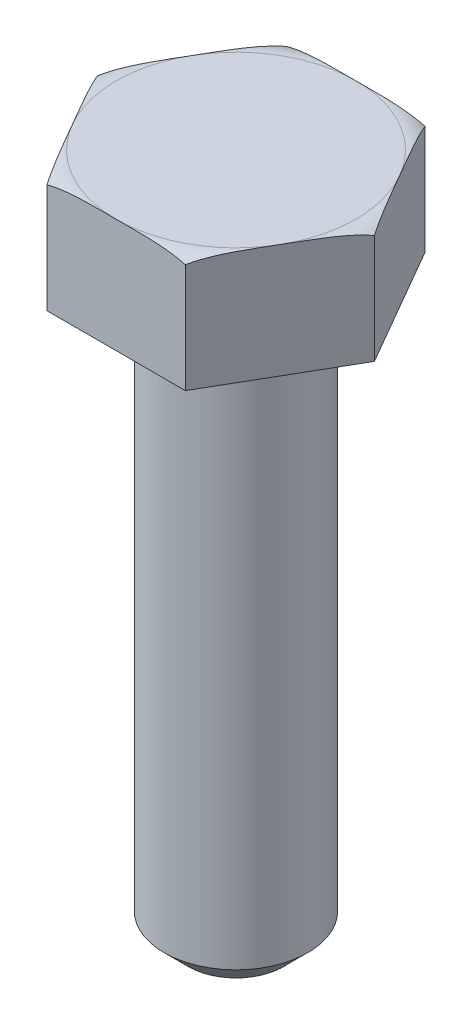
SolidWorks part; units mm, degrees
ref_plane "Plan1" through (0, 0, 0) normal (0, 0, 1) x (1, 0, 0)
ref_plane "Plan2" through (0, 0, 0) normal (0, 1, 0) x (1, 0, 0)
ref_plane "Plan3" through (0, 0, 0) normal (1, 0, 0) x (0, 0, -1)
sketch "Esquisse4" plane through (0, 0, 0) normal (0, 1, 0) x (1, 0, 0)
  line L1 (4.6188, 0) -> (2.3094, 4)
  line L2 (2.3094, 4) -> (-2.3094, 4)
  line L3 (-2.3094, 4) -> (-4.6188, 0)
  line L4 (-4.6188, 0) -> (-2.3094, -4)
  line L5 (-2.3094, -4) -> (2.3094, -4)
  line L6 (2.3094, -4) -> (4.6188, 0)
  circle A0 centre (0, 0) radius 4 construction
  dimension "S" = 8
extrude "Extrusion1" add sketch "Esquisse4" along normal blind 3.8
sketch "Esquisse1" plane through (0, 0, 0) normal (0, 0, 1) x (1, 0, 0)
  line L0 (0, 0) -> (0, -19) construction
  line L3 (0, 0) -> (2.64, 0)
  line L4 (2.4, -0.24) -> (2.4, -18.2)
  line L5 (1.6, -19) -> (0, -19)
  line L6 (2.4, -18.2) -> (1.6, -19)
  line L7 (0, -19) -> (0, 0)
  arc A1 (2.64, 0) -> (2.4, -0.24) centre (2.64, -0.24) ccw
  point P12 (2.4, -19)
  dimension "C2" = 0.24
  dimension "R" = 0.8
  dimension "D2" = 45
  dimension "L1" = 19
  dimension "D" = 4.8
revolve "Révolution1" add sketch "Esquisse1" angle 360 about L0
sketch "Esquisse2" plane through (0, 6, 0) normal (0, 0, -1) x (1, 0, 0)
  line L0 (4, 2.2) -> (4.6188, 2.2)
  line L1 (2.3094, 2.2) -> (4.6188, 2.2) construction
  line L2 (4.6188, 2.2) -> (4.6188, 6) construction
  line L3 (4.6188, 2.2) -> (4.6188, 2.3614)
  line L9 (4, 2.2) -> (4, 6) construction
  line L12 (0, 6) -> (0, 2.2) construction
  arc A0 (4, 2.2) -> (4.6188, 2.3614) centre (4, 3.4667) ccw
  dimension "D1" = 1.2667
revolve "Enlèvement de matière-Révolution1" cut sketch "Esquisse2" angle 360 about L12
equation "\"C2@Esquisse1\"=\"D@Esquisse1\"/20"
equation "\"R@Esquisse1\"=(\"D@Esquisse1\"-\"D2@Représentation de filetage1\")/2"
equation "\"D1@Esquisse2\"=\"H@Extrusion1\"/3"
